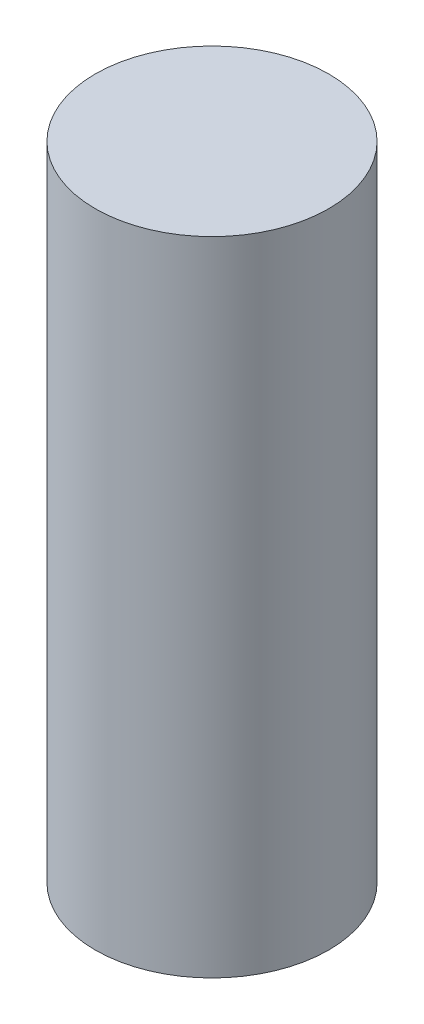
SolidWorks part; units mm, degrees
ref_plane "Front Plane" through (0, 0, 0) normal (0, 0, 1) x (1, 0, 0)
ref_plane "Top Plane" through (0, 0, 0) normal (0, 1, 0) x (1, 0, 0)
ref_plane "Right Plane" through (0, 0, 0) normal (1, 0, 0) x (0, 0, -1)
sketch "Esquisse1" plane through (0, 0, 0) normal (0, 0, 1) x (1, 0, 0)
  line L0 (1, 10) -> (0, 10)
  line L1 (0, 10) -> (0, 4.5)
  line L2 (0, 4.5) -> (1, 4.5)
  line L3 (1, 4.5) -> (1, 10)
  line L4 (0, 10) -> (0, 4.5) construction
revolve "Révolution1" add sketch "Esquisse1" angle 360 about L4
